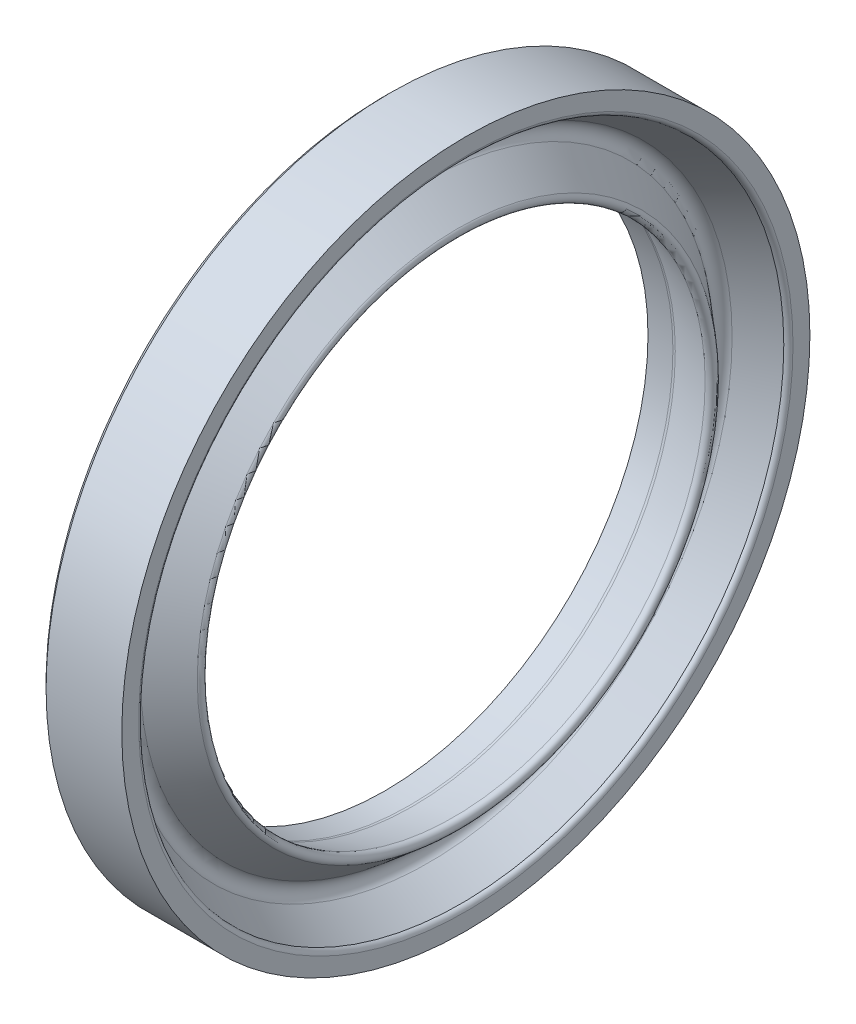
SolidWorks part; units mm, degrees
ref_plane "Plan1" through (0, 0, 0) normal (0, 0, 1) x (1, 0, 0)
ref_plane "Plan2" through (0, 0, 0) normal (0, 1, 0) x (1, 0, 0)
ref_plane "Plan3" through (0, 0, 0) normal (1, 0, 0) x (0, 0, -1)
sketch "Esquisse1" plane through (0, 0, 0) normal (0, 0, 1) x (-1, 0, 0)
  line L0 (9.1, 45.5) -> (9.75, 44.85)
  line L3 (0, 45.5) -> (9.1, 45.5)
  line L4 (0, 45.5) -> (0, 41.8054)
  line L5 (0.325, 41.2425) -> (4.3741, 38.9047)
  line L6 (9.75, 44.85) -> (9.75, 33.8933)
  line L7 (4.5597, 36.783) -> (0.7392, 33.5772)
  line L8 (0, 0) -> (0, 14) construction
  line L9 (-2.434, 0) -> (3.3798, 0) construction
  line L10 (9.75, 33.8933) -> (6.6711, 33.8933)
  line L11 (6.3347, 33.849) -> (1.3, 32.5)
  arc A0 (6.6711, 33.8933) -> (6.3347, 33.849) centre (6.6711, 32.5933) ccw
  arc A1 (4.3741, 38.9047) -> (4.5597, 36.783) centre (3.7241, 37.7789) cw
  arc A2 (0.325, 41.2425) -> (0, 41.8054) centre (0.65, 41.8054) cw
  arc A4 (0.7392, 33.5772) -> (1.3, 32.5) centre (1.139, 33.1008) ccw
  point P10 (2, 10.4287)
  point P13 (1.8406, 11.685)
  point P20 (1.8406, 11.685)
  point P24 (0, 41.4301)
  dimension "D7" = 2
  dimension "D9" = 1.8406
sketch "Esquisse2" plane through (0, 0, 0) normal (0, 0, 1) x (1, 0, 0)
  line L8 (-9.1, -42.5) -> (-9.75, -41.85)
  line L9 (-9.75, -41.85) -> (-9.75, -32.5)
  line L10 (0.25, -42.5) -> (-9.1, -42.5)
  line L11 (0.25, -42.5) -> (0.25, -40.412)
  line L12 (-0.325, -39.8491) -> (-4.3741, -37.5114)
  line L13 (-4.5597, -35.3897) -> (-0.7392, -32.1839)
  line L14 (-6.3347, -32.4557) -> (-1.3, -31.1067)
  line L15 (-9.75, -32.5) -> (-6.6711, -32.5)
  line L16 (2.434, 0) -> (-3.3798, 0) construction
  arc A4 (0.25, -40.412) -> (-0.325, -39.8491) centre (-0.3946, -40.4954) ccw
  arc A5 (-6.6711, -32.5) -> (-6.3347, -32.4557) centre (-6.6711, -31.2) ccw
  arc A6 (-4.5597, -35.3897) -> (-4.3741, -37.5114) centre (-3.7241, -36.3855) ccw
  arc A7 (-0.7392, -32.1839) -> (-1.3, -31.1067) centre (-1.139, -31.7074) ccw
  dimension "D1" = 32.5
  dimension "D2" = 42.5
  dimension "D3" = 10
revolve "Révolution2" add sketch "Esquisse2" angle 360 about L9
